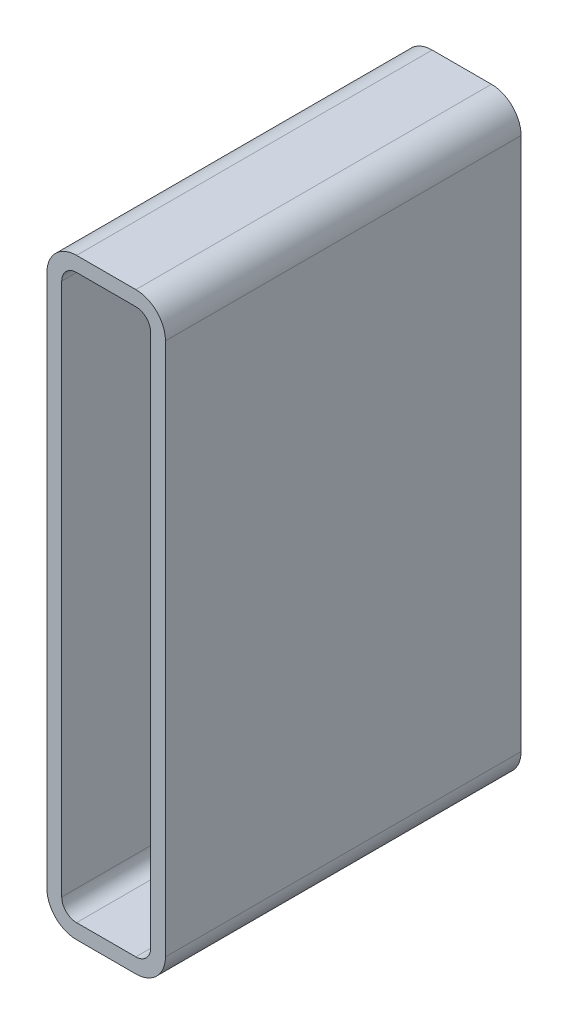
SolidWorks part; units mm, degrees
ref_plane "Front Plane" through (0, 0, 0) normal (0, 0, 1) x (1, 0, 0)
ref_plane "Top Plane" through (0, 0, 0) normal (0, 1, 0) x (1, 0, 0)
ref_plane "Right Plane" through (0, 0, 0) normal (1, 0, 0) x (0, 0, -1)
sketch "Sketch1" plane through (0, 0, 0) normal (0, 0, 1) x (1, 0, 0)
sketch_block_instance "HSS20x4x0.500-1"
sketch_block "HSS20x4x0.500"
extrude "Boss-Extrude1" add sketch "Sketch1" along normal blind 304.8
